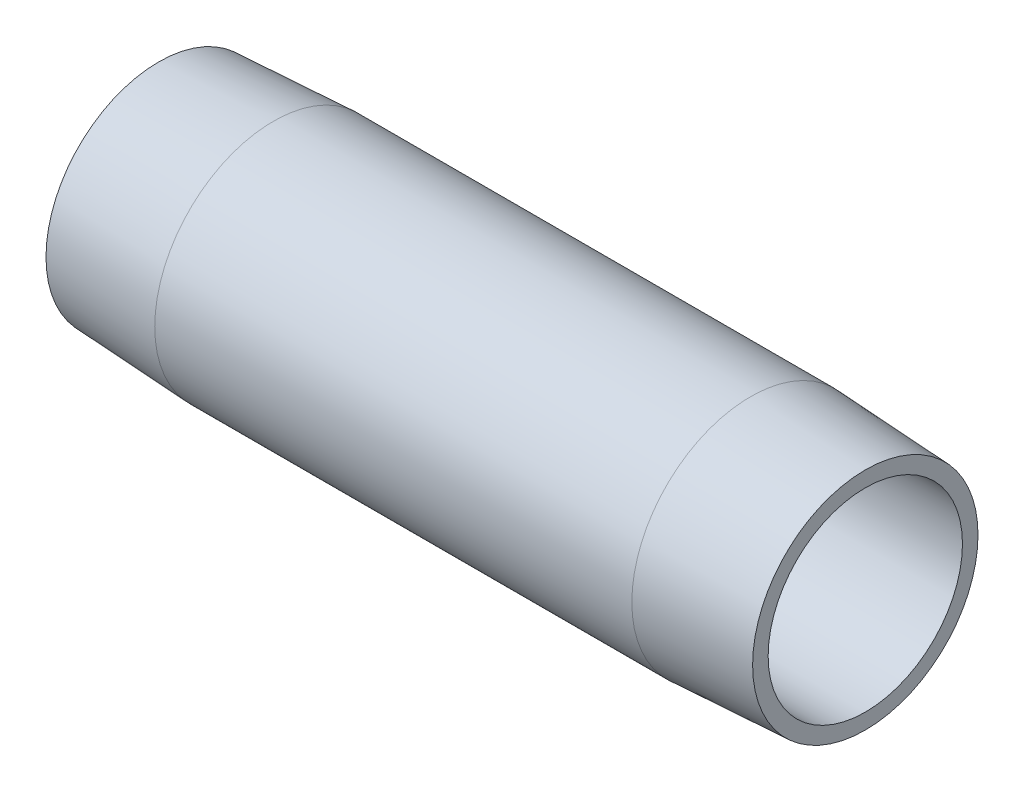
SolidWorks part; units mm, degrees
ref_plane "Front Plane" through (0, 0, 0) normal (0, 0, 1) x (1, 0, 0)
ref_plane "Top Plane" through (0, 0, 0) normal (0, 1, 0) x (1, 0, 0)
ref_plane "Right Plane" through (0, 0, 0) normal (1, 0, 0) x (0, 0, -1)
sketch "Sketch1" plane through (0, 0, 0) normal (0, 0, 1) x (1, 0, 0)
  line L6 (63.5, 8.7313) -> (0, 8.7313)
  line L7 (10.3124, 10.668) -> (0, 10.1276)
  line L8 (53.1876, 10.668) -> (10.3124, 10.668)
  line L9 (63.5, 10.1276) -> (53.1876, 10.668)
  line L10 (63.5, 8.7313) -> (63.5, 10.1276)
  line L11 (0, 10.1276) -> (0, 8.7313)
  line L12 (0, 0) -> (50000, 0) construction
  line L13 (0, -55) -> (0, 55) construction
  dimension "D1" = 63.5
  dimension "D2" = 3
  dimension "D3" = 3
  dimension "D4" = 21.336
  dimension "D5" = 17.4625
  dimension "D6" = 10.3124
  dimension "D7" = 10.3124
revolve "Revolve1" add sketch "Sketch1" angle 360 about L12
